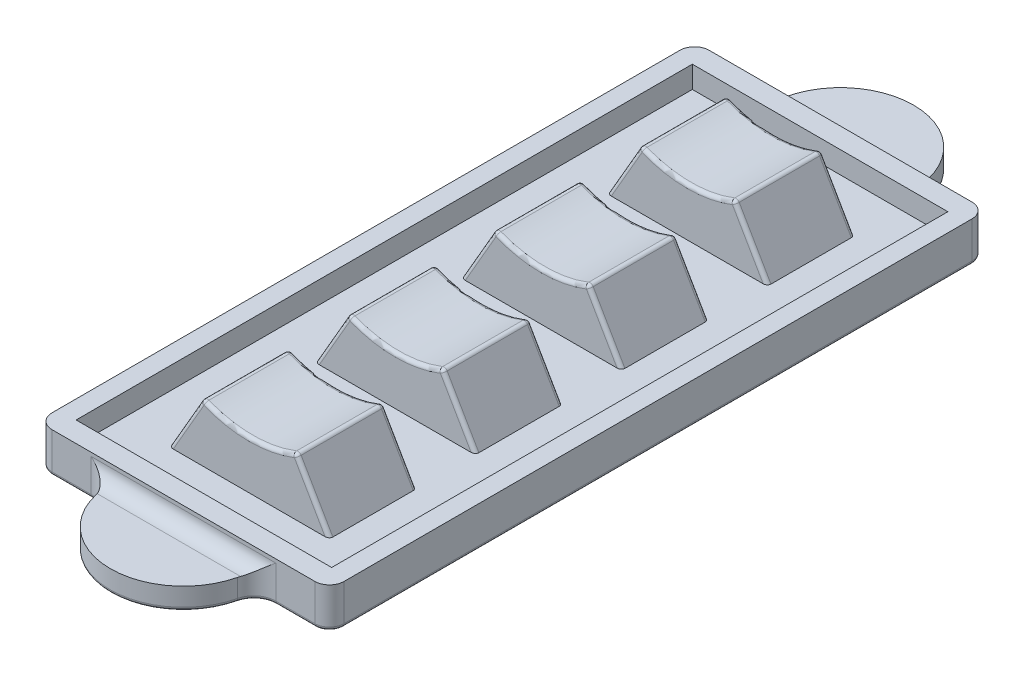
SolidWorks part; units mm, degrees
ref_plane "前视基准面" through (0, 0, 0) normal (0, 0, 1) x (1, 0, 0)
ref_plane "上视基准面" through (0, 0, 0) normal (0, 1, 0) x (1, 0, 0)
ref_plane "右视基准面" through (0, 0, 0) normal (1, 0, 0) x (0, 0, -1)
sketch "Sketch1" plane through (0, 0, 0) normal (0, 0, 1) x (1, 0, 0)
  line L0 (0, 0) -> (-13.2791, -23) construction
  line L1 (-13.2791, -23) -> (13.2791, -23) construction
  line L2 (13.2791, -23) -> (0, 0) construction
  line L3 (0, -23) -> (0, 0) construction
  circle A0 centre (0, 0) radius 13.4 construction
  dimension "D1" = 26.8
  dimension "D2" = 30
  dimension "D3" = 23
sketch "Sketch2" plane through (0, 0, 0) normal (0, 0, 1) x (1, 0, 0)
  line L0 (-13.2791, -23) -> (13.2791, -23) construction
  line L1 (13.2791, -23) -> (0, 0) construction
  line L2 (0, 0) -> (-13.2791, -23) construction
  line L3 (-13.2791, -23) -> (13.2791, -23)
  line L4 (13.2791, -23) -> (6.7, -11.6047)
  line L5 (-6.7, -11.6047) -> (-13.2791, -23)
  line L6 (-4.9679, -12.6047) -> (-11.547, -24)
  line L7 (11.547, -24) -> (4.9679, -12.6047)
  circle A0 centre (0, 0) radius 13.4 construction
  arc A1 (-6.7, -11.6047) -> (6.7, -11.6047) centre (0, 0) ccw
  arc A2 (-8.2, -14.2028) -> (8.2, -14.2028) centre (0, 0) ccw
  dimension "D1" = 2
  dimension "D2" = 3
extrude "Boss-Extrude1" add sketch "Sketch2" along normal mid plane 12 contours A2 L6 L3 L7
fillet "Fillet1" radius 0.5 8 edges at (6.4067, -15.0968, 0) (0, -16.4, 6) (-6.4067, -15.0968, 0) (0, -16.4, -6) (-8.6882, -19.0484, -6) (8.6882, -19.0484, -6) (-8.6882, -19.0484, 6) (8.6882, -19.0484, 6)
sketch "Sketch3" plane through (0, -23, 0) normal (0, -1, 0) x (1, 0, 0)
  line L1 (-20, -10) -> (20, -10)
  line L2 (-20, -10) -> (-20, 10)
  line L3 (-20, 10) -> (20, 10)
  line L4 (20, -10) -> (20, 10)
  line L5 (-20, -10) -> (20, 10) construction
  line L6 (-20, 10) -> (20, -10) construction
  point P0 (0, 0)
  dimension "D1" = 20
  dimension "D2" = 40
extrude "Boss-Extrude2" add sketch "Sketch3" along normal blind 2.5
pattern_linear "LPattern1" count 4 spacing 20 along (0, 0, -1)
combine bodies "Combine1" operation type add bodies to combine 107 108 109 110
sketch "Sketch5" plane through (0, -25.5, 0) normal (0, -1, 0) x (1, 0, 0)
  line L0 (0, 10) -> (0, -70) construction
  line L1 (20, 10) -> (-20, 10) construction
  line L2 (-20, -70) -> (20, -70) construction
  line L3 (20, -70) -> (20, 10) construction
  line L4 (-20, -75) -> (20, -75)
  line L5 (-20, -75) -> (-20, 15)
  line L6 (-20, 15) -> (20, 15)
  line L7 (20, -75) -> (20, 15)
  line L8 (-20, -75) -> (20, 15) construction
  line L9 (-20, 15) -> (20, -75) construction
  point P6 (0, -30)
  dimension "D1" = 5
extrude "Boss-Extrude3" add sketch "Sketch5" against normal blind 2.5
sketch "Sketch6" plane through (0, -23, 0) normal (0, 1, 0) x (1, 0, 0)
  line L0 (0, 75) -> (0, -15) construction
  line L1 (-20, 75) -> (20, 75) construction
  line L2 (20, -15) -> (-20, -15) construction
  line L3 (-20, -15) -> (-20, 75) construction
  line L4 (-17.5, -12.2) -> (17.5, -12.2)
  line L5 (-17.5, -12.2) -> (-17.5, 72.2)
  line L6 (-17.5, 72.2) -> (17.5, 72.2)
  line L7 (17.5, -12.2) -> (17.5, 72.2)
  line L8 (-17.5, -12.2) -> (17.5, 72.2) construction
  line L9 (-17.5, 72.2) -> (17.5, -12.2) construction
  line L14 (20, -15) -> (20, 75)
  line L15 (20, 75) -> (-20, 75)
  line L16 (-20, 75) -> (-20, -15)
  line L17 (-20, -15) -> (20, -15)
  line L18 (20, -15) -> (20, 75)
  line L19 (20, 75) -> (-20, 75)
  line L20 (-20, 75) -> (-20, -15)
  line L21 (-20, -15) -> (20, -15)
  point P6 (0, 30)
  dimension "D1" = 2.8
  dimension "D2" = 2.5
  dimension "D3" = 0
extrude "Boss-Extrude4" add sketch "Sketch6" along normal blind 3 contours L7 L4 L5 L6 M20 M17 M18 M19 | L18 L19 L20 L21
sketch "Sketch7" plane through (0, -25.5, 0) normal (0, -1, 0) x (1, 0, 0)
  line L0 (0, 15) -> (0, -75) construction
  line L1 (20, 15) -> (-20, 15) construction
  line L2 (-20, -75) -> (20, -75) construction
  line L3 (10, 15) -> (10, -75)
  line L4 (-10, 15) -> (-10, -75)
  arc A0 (10, 15) -> (-10, 15) centre (0, 15) ccw
  arc A1 (-10, -75) -> (10, -75) centre (0, -75) ccw
  point P6 (0, -30)
  point P11 (10.4901, -75)
  dimension "D1" = 10
extrude "Boss-Extrude5" add sketch "Sketch7" against normal blind 3 contours A1 M8 | A0 M6
fillet "Fillet2" radius 3 4 edges at (-10, -24, -75) (10, -24, -75) (-10, -24, 15) (10, -24, 15)
fillet "Fillet3" radius 2 2 edges at (0, -22.5, 15) (0, -22.5, -75)
fillet "Fillet4" radius 2 4 edges at (20, -22.75, 15) (-20, -22.75, 15) (-20, -22.75, -75) (20, -22.75, -75)
fillet "Fillet5" radius 0.5 16 edges at (19.4142, -25.5, -74.4142) (15.3246, -25.5, -75) (10.7886, -25.5, -75.6466) (0, -25.5, -85) (-10.7886, -25.5, -75.6466) (-15.3246, -25.5, -75) (-19.4142, -25.5, -74.4142) (-20, -25.5, -30) (-19.4142, -25.5, 14.4142) (-15.3246, -25.5, 15) (-10.7886, -25.5, 15.6466) (0, -25.5, 25) (10.7886, -25.5, 15.6466) (15.3246, -25.5, 15) (19.4142, -25.5, 14.4142) (20, -25.5, -30)
